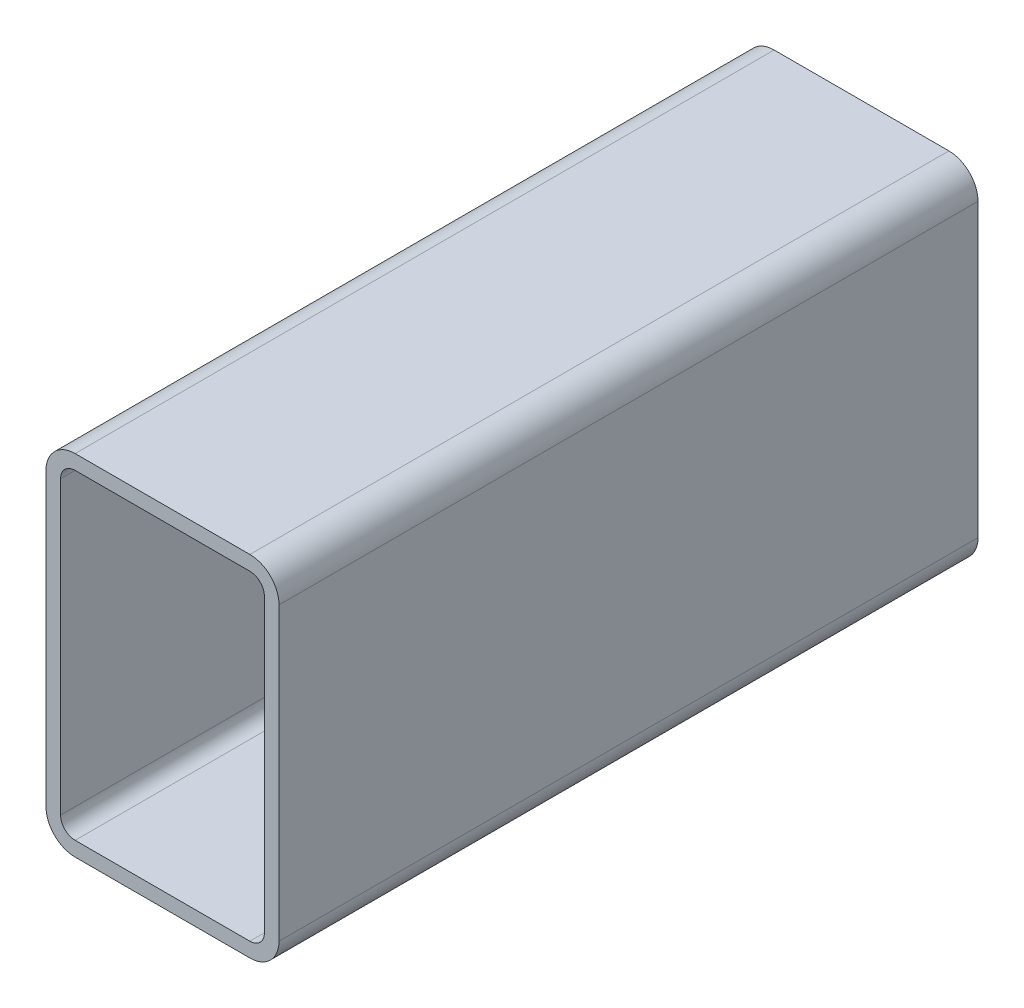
SolidWorks part; units mm, degrees
ref_plane "Front Plane" through (0, 0, 0) normal (0, 0, 1) x (1, 0, 0)
ref_plane "Top Plane" through (0, 0, 0) normal (0, 1, 0) x (1, 0, 0)
ref_plane "Right Plane" through (0, 0, 0) normal (1, 0, 0) x (0, 0, -1)
sketch "Sketch1" plane through (0, 0, 0) normal (0, 0, 1) x (1, 0, 0)
  point P0 (0, 0)
sketch_block_instance "HSS6x4x0.250-1"
sketch_block "HSS6x4x0.250"
extrude "Boss-Extrude1" add sketch "Sketch1" along normal blind 304.8
